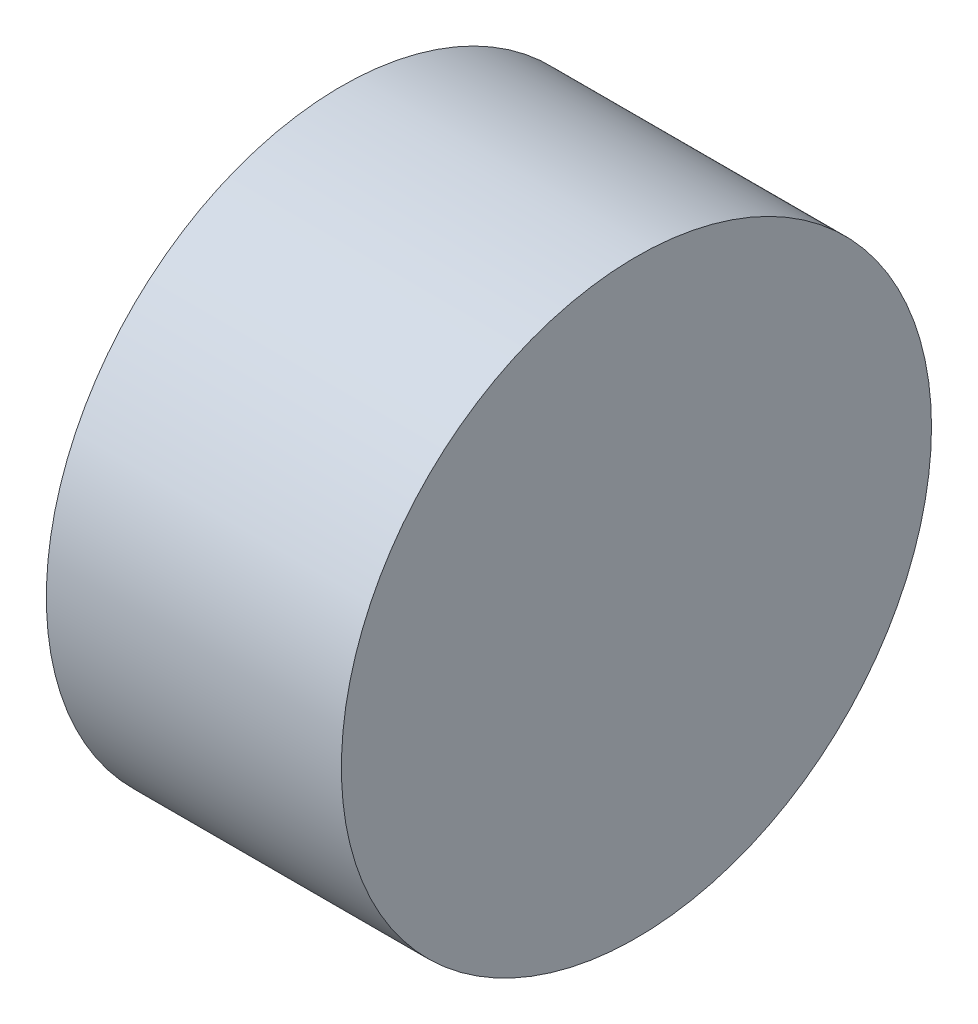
SolidWorks part; units mm, degrees
ref_plane "Front Plane" through (0, 0, 0) normal (0, 0, 1) x (1, 0, 0)
ref_plane "Top Plane" through (0, 0, 0) normal (0, 1, 0) x (1, 0, 0)
ref_plane "Right Plane" through (0, 0, 0) normal (1, 0, 0) x (0, 0, -1)
sketch "Sketch1" plane through (0, 0, 0) normal (1, 0, 0) x (0, 0, -1)
  circle A0 centre (0, 0) radius 30
  circle A1 centre (0, 0) radius 2.5
  dimension "D1" = 60
  dimension "D2" = 5
extrude "Boss-Extrude1" add sketch "Sketch1" along normal blind 10
sketch "Sketch2" plane through (10, 0, 0) normal (1, 0, 0) x (0, 0, -1)
  circle A0 centre (0, 0) radius 30
  circle A3 centre (0, 0) radius 30 construction
extrude "Boss-Extrude2" add sketch "Sketch2" along normal blind 20
